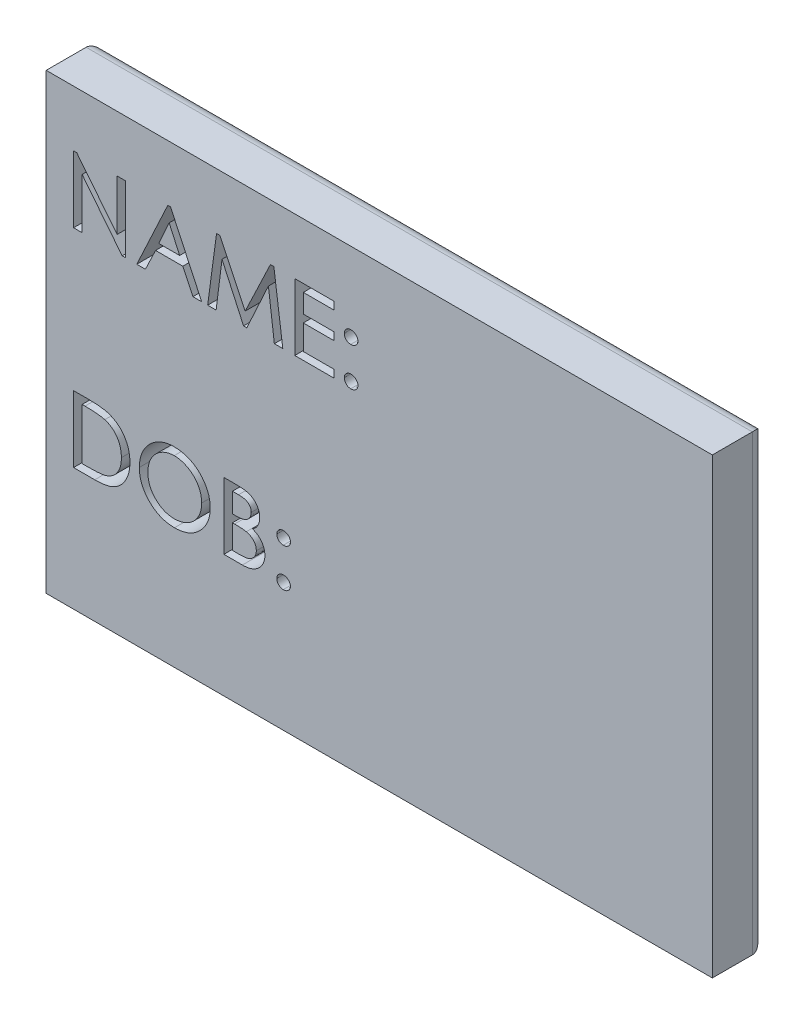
SolidWorks part; units mm, degrees
ref_plane "Front Plane" through (0, 0, 0) normal (0, 0, 1) x (1, 0, 0)
ref_plane "Top Plane" through (0, 0, 0) normal (0, 1, 0) x (1, 0, 0)
ref_plane "Right Plane" through (0, 0, 0) normal (1, 0, 0) x (0, 0, -1)
sketch "Sketch1" plane through (0, 0, 0) normal (0, 0, 1) x (1, 0, 0)
  line L1 (-15.875, -10.795) -> (15.875, -10.795)
  line L2 (-15.875, -10.795) -> (-15.875, 10.795)
  line L3 (-15.875, 10.795) -> (15.875, 10.795)
  line L4 (15.875, -10.795) -> (15.875, 10.795)
  line L5 (-15.875, -10.795) -> (15.875, 10.795) construction
  line L6 (-15.875, 10.795) -> (15.875, -10.795) construction
  point P0 (0, 0)
  dimension "D1" = 31.75
  dimension "D2" = 21.59
extrude "Boss-Extrude1" add sketch "Sketch1" along normal blind 2.54
fillet "Fillet1" radius 0.635 4 edges at (-15.875, 0, 0) (0, -10.795, 0) (0, 10.795, 0) (15.875, 0, 0)
sketch "Sketch2" plane through (0, 0, 2.54) normal (0, 0, 1) x (1, 0, 0)
  line L0 (-15.875, 10.795) -> (-14.977, 9.897) construction
  line L2 (-14.977, 9.897) -> (-14.977, 4.9485) construction
  line L3 (-14.977, 4.9485) -> (-14.977, 0) construction
  line L4 (-14.977, 0) -> (-14.977, -4.9485) construction
  line L5 (-14.977, -4.9485) -> (-14.977, -9.897) construction
  line L6 (-14.977, -9.897) -> (-15.875, -10.795) construction
  line L7 (15.875, 10.795) -> (-15.875, 10.795) construction
  line L8 (-15.875, -10.795) -> (15.875, -10.795) construction
  line L9 (-14.977, 4.9485) -> (14.977, 4.9485) construction
  line L10 (14.977, 4.9485) -> (14.977, 0) construction
  line L11 (14.977, 0) -> (-14.977, 0) construction
  line L12 (14.977, 0) -> (14.977, -4.9485) construction
  line L13 (14.977, -4.9485) -> (-14.977, -4.9485) construction
  line L14 (-14.977, -9.897) -> (14.977, -9.897) construction
  line L15 (14.977, -9.897) -> (14.977, -4.9485) construction
  line L16 (-14.977, 9.897) -> (14.977, 9.897) construction
  line L17 (14.977, 9.897) -> (14.977, 4.9485) construction
  line L18 (14.977, 9.897) -> (15.875, 10.795) construction
  line L19 (14.977, -9.897) -> (15.875, -10.795) construction
  text T0 "<b>NAME: </b>"
  text T1 "<b>DOB: </b>"
  dimension "D1" = 45
  dimension "D2" = 45
  dimension "D3" = 1.27
extrude "Cut-Extrude1" cut sketch "Sketch2" against normal blind 1.905
